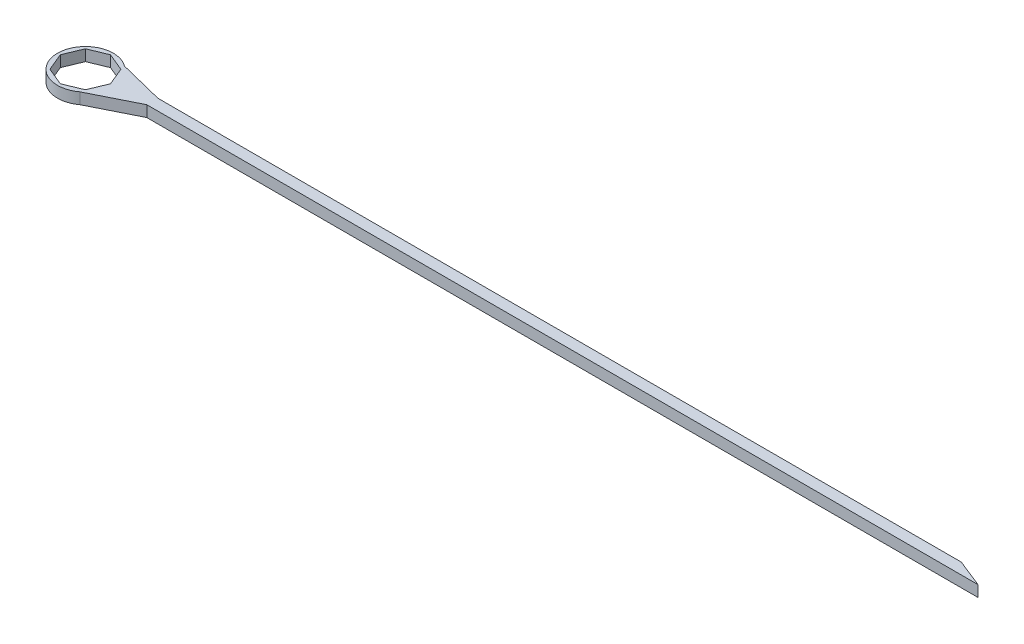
SolidWorks part; units mm, degrees
ref_plane "Front Plane" through (0, 0, 0) normal (0, 0, 1) x (1, 0, 0)
ref_plane "Top Plane" through (0, 0, 0) normal (0, 1, 0) x (1, 0, 0)
ref_plane "Right Plane" through (0, 0, 0) normal (1, 0, 0) x (0, 0, -1)
sketch "Sketch1" plane through (0, 0, 0) normal (0, 1, 0) x (1, 0, 0)
  line L0 (5.5, 0) -> (80, 0)
  line L2 (2.25, 0) -> (1.591, 1.591)
  line L3 (1.591, 1.591) -> (0, 2.25)
  line L4 (0, 2.25) -> (-1.591, 1.591)
  line L5 (-1.591, 1.591) -> (-2.25, 0)
  line L6 (-2.25, 0) -> (-1.591, -1.591)
  line L7 (-1.591, -1.591) -> (0, -2.25)
  line L8 (0, -2.25) -> (1.591, -1.591)
  line L9 (1.591, -1.591) -> (2.25, 0)
  line L10 (80, 0) -> (77.5, 1)
  line L11 (77.5, 1) -> (5.5, 1)
  line L12 (5.5, 1) -> (1.5, 2)
  line L13 (5.5, 0) -> (1.5, -2)
  arc A0 (1.5, 2) -> (1.5, -2) centre (0, 0) ccw
  circle A1 centre (0, 0) radius 2.25 construction
  dimension "D1" = 5
  dimension "D2" = 4.5
  dimension "D3" = 1
  dimension "D4" = 2.5
  dimension "D5" = 2
  dimension "D6" = 4
  dimension "D7" = 80
  dimension "D8" = 2
extrude "Boss-Extrude1" add sketch "Sketch1" along normal blind 1
sketch "Sketch2" plane through (0, 1, 0) normal (0, 1, 0) x (1, 0, 0)
  line L0 (0, 0) -> (16, 0)
  line L1 (5.5, 0) -> (80, 0) construction
  line L2 (16, 0) -> (23.6429, 0)
  line L3 (23.6429, 0) -> (31.2857, 0)
  line L4 (31.2857, 0) -> (38.9286, 0)
  line L5 (38.9286, 0) -> (46.5714, 0)
  line L6 (46.5714, 0) -> (54.2143, 0)
  line L7 (54.2143, 0) -> (61.8571, 0)
  line L8 (61.8571, 0) -> (69.5, 0)
  line L10 (69.5, 0) -> (77.5, 0)
  dimension "D1" = 16
  dimension "D2" = 8
